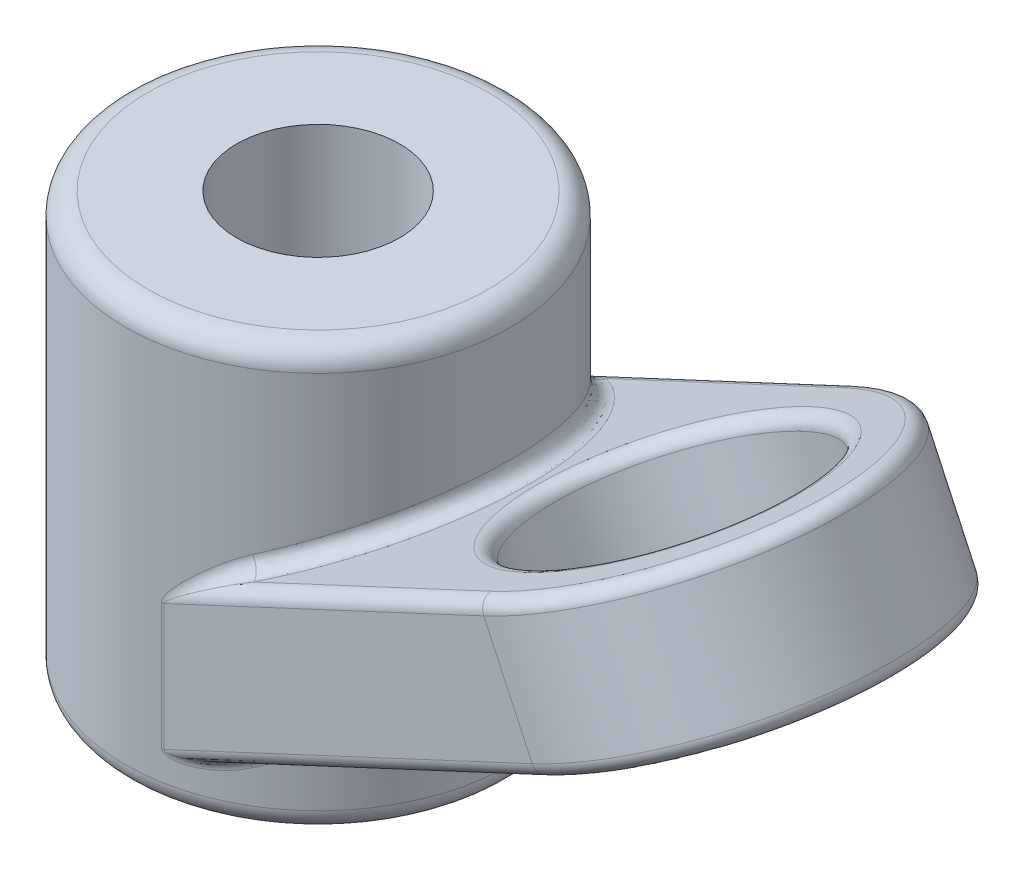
SolidWorks part; units mm, degrees
ref_plane "Plane1" through (0, 0, 0) normal (0, 0, 1) x (1, 0, 0)
ref_plane "Plane2" through (0, 0, 0) normal (0, 1, 0) x (1, 0, 0)
ref_plane "Plane3" through (0, 0, 0) normal (1, 0, 0) x (0, 0, -1)
sketch "Esquisse1" plane through (0, 0, 0) normal (0, 0, 1) x (1, 0, 0)
  line L0 (-38.7, 96) -> (-18.5, 96)
  line L1 (-43.7, 91) -> (-43.7, 5)
  line L2 (-33.7, 0) -> (-38.7, 0)
  line L3 (-18.5, 4) -> (-18.5, 96)
  line L4 (-33.7, 4) -> (-33.7, 0)
  line L5 (-33.7, 4) -> (-18.5, 4)
  line L6 (0, 101.2789) -> (0, -43.6652) construction
  arc A0 (-43.7, 91) -> (-38.7, 96) centre (-38.7, 91) cw
  arc A1 (-38.7, 0) -> (-43.7, 5) centre (-38.7, 5) cw
  point P14 (-43.7, 96)
  point P17 (-43.7, 0)
  dimension "D6" = 5
  dimension "D1" = 18.5
  dimension "D2" = 96
  dimension "D3" = 43.7
  dimension "D4" = 4
  dimension "D5" = 33.7
revolve "Base-Révolution" add sketch "Esquisse1" angle 360 about L6
ref_plane "Plan4" through (0, 22.3, 0) normal (0, 1, 0) x (-1, 0, 0)
sketch "Esquisse4" plane through (0, 22.3, 0) normal (0, 1, 0) x (-1, 0, 0)
  line L0 (0, 45.3889) -> (0, -47.2361) construction
ref_plane "Plan5" through (-8.5414, 18.3171, 0) normal (-0.4226, 0.9063, 0) x (-0.9063, -0.4226, 0)
sketch "Esquisse5" plane through (-8.5414, 18.3171, 0) normal (-0.4226, 0.9063, 0) x (-0.9063, -0.4226, 0)
  line L0 (-81.3926, 0) -> (137.5608, 0) construction
  line L1 (-9.4244, 45.3889) -> (-9.4244, -47.2361) construction
  line L2 (-104.4244, 43) -> (-57.6418, 43)
  line L3 (-104.4244, -43) -> (-57.6418, -43)
  line L4 (-57.6418, 43) -> (-57.6418, -43)
  circle A0 centre (-104.4244, 0) radius 25.6
  arc A1 (-104.4244, 43) -> (-104.4244, -43) centre (-104.4244, 0) ccw
  dimension "D2" = 51.2
  dimension "D3" = 86
  dimension "D1" = 95
  dimension "D4" = 46.7826
extrude "Boss.-Extru.1" add sketch "Esquisse5" along normal mid plane 32
sketch "Esquisse7" plane through (52.2412, 24.3605, 0) normal (-0.9063, -0.4226, 0) x (0, 0, 1)
  line L3 (-23.3512, 36.2107) -> (-43, 36.2107)
  line L4 (-23.3512, 36.2107) -> (-43, 36.2107)
  line L5 (43, 36.2107) -> (23.3512, 36.2107)
  line L8 (-43, 36.2107) -> (-43, 4.2107)
  line L9 (43, 4.2107) -> (43, 36.2107)
  line L10 (43, 36.2107) -> (23.3512, 36.2107)
  line L11 (-43, 36.2107) -> (-43, 4.2107)
  line L12 (-43, 4.2107) -> (43, 4.2107)
  line L13 (-43, 4.2107) -> (43, 4.2107)
  line L14 (43, 4.2107) -> (43, 36.2107)
  ellipse E1 centre (0, 123.6132) end of major axis (0, 227.0162) minor radius 43.7 (-23.3512, 36.2107) -> (23.3512, 36.2107) ccw
  ellipse E2 centre (0, 123.6132) end of major axis (0, 227.0162) minor radius 43.7 (-23.3512, 36.2107) -> (23.3512, 36.2107) ccw
  dimension "D1" = 0
extrude "Boss.-Extru.2" add sketch "Esquisse7" along normal up to next
sketch "Esquisse9" plane through (-15.3033, 32.818, 0) normal (-0.4226, 0.9063, 0) x (-0.9063, -0.4226, 0)
  circle A0 centre (-104.4244, 0) radius 29.6
  dimension "D1" = 59.2
extrude "Enlèv. mat.-Extru.2" cut sketch "Esquisse9" against normal blind 23
fillet "Congé5" radius 3
equation "\"D4@Esquisse5\" = \"D1@Esquisse5\" - \"D3@Esquisse1\" / cos(\"D1@Plan5\"*0.01745293)"
